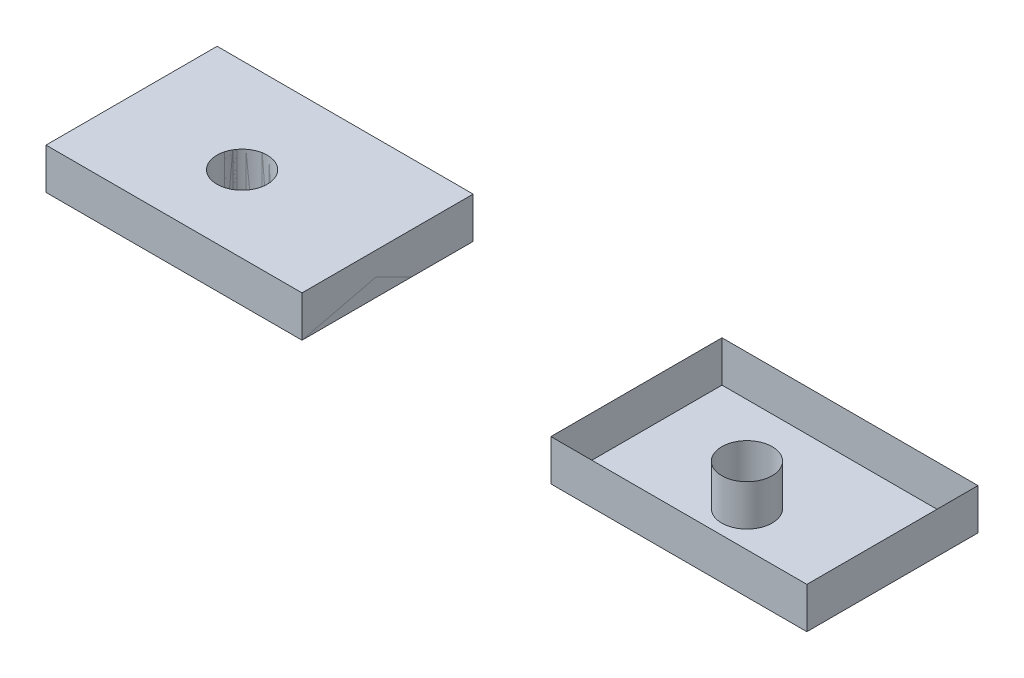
SolidWorks part; units mm, degrees
ref_plane "Front Plane" through (0, 0, 0) normal (0, 0, 1) x (1, 0, 0)
ref_plane "Top Plane" through (0, 0, 0) normal (0, 1, 0) x (1, 0, 0)
ref_plane "Right Plane" through (0, 0, 0) normal (1, 0, 0) x (0, 0, -1)
sketch "Sketch1" plane through (0, 0, 0) normal (0, 1, 0) x (1, 0, 0)
  line L1 (0, 0) -> (50.6728, 0)
  line L2 (0, 0) -> (0, 50.8373)
  line L3 (0, 50.8373) -> (50.6728, 50.8373)
  line L4 (50.6728, 0) -> (50.6728, 50.8373)
sketch "Sketch2" plane through (0, 0, 0) normal (0, 1, 0) x (1, 0, 0)
  line L1 (174.2754, 0) -> (303.8652, 0)
  line L2 (174.2754, 0) -> (174.2754, 86.6255)
  line L3 (174.2754, 86.6255) -> (303.8652, 86.6255)
  line L4 (303.8652, 0) -> (303.8652, 86.6255)
extrude "Extrude1" add sketch "Sketch2" along normal blind 20.7672
sketch "Sketch3" plane through (0, 20.7672, 0) normal (0, 1, 0) x (-1, 0, 0)
  circle A0 centre (-234.6991, -38.8355) radius 12.7581
extrude "Cut-Extrude1" cut sketch "Sketch3" against normal through all
imported_body "Surface-Imported1"
move or copy body "Body-Move/Copy1" bodies to move or copy 104
